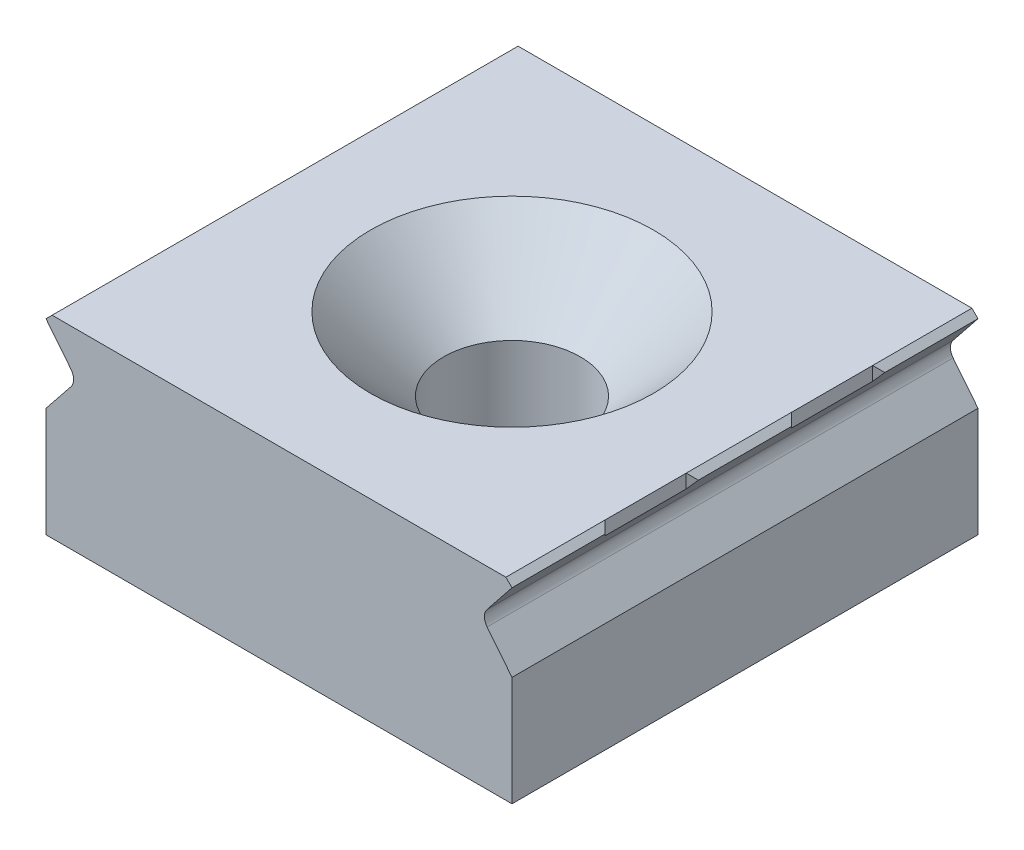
SolidWorks part; units mm, degrees
ref_plane "Front Plane" through (0, 0, 0) normal (0, 0, 1) x (1, 0, 0)
ref_plane "Top Plane" through (0, 0, 0) normal (0, 1, 0) x (1, 0, 0)
ref_plane "Right Plane" through (0, 0, 0) normal (1, 0, 0) x (0, 0, -1)
sketch "Sketch1" plane through (0, 0, 0) normal (0, 1, 0) x (1, 0, 0)
  line L1 (9.55, -9.55) -> (-9.55, -9.55)
  line L2 (9.55, -9.55) -> (9.55, 9.55)
  line L3 (9.55, 9.55) -> (-9.55, 9.55)
  line L4 (-9.55, -9.55) -> (-9.55, 9.55)
  line L5 (9.55, -9.55) -> (-9.55, 9.55) construction
  line L6 (9.55, 9.55) -> (-9.55, -9.55) construction
  point P0 (0, 0)
  dimension "D1" = 19.1
  dimension "D2" = 19.1
extrude "Boss-Extrude1" add sketch "Sketch1" along normal mid plane 7.92
chamfer "Chamfer1" distance 0.25 angle 45 2 edges at (9.55, 3.96, 0) (-9.55, 3.96, 0)
sketch "Sketch2" plane through (0, 0, 9.55) normal (0, 0, 1) x (1, 0, 0)
  line L0 (-9.55, 3.71) -> (-9.55, 0.53)
  line L1 (-9.55, 3.71) -> (-9.55, -3.96) construction
  line L2 (-9.55, 3.71) -> (-8.5292, 2.432)
  line L3 (-8.5292, 1.808) -> (-9.55, 0.53)
  arc A0 (-8.5292, 2.432) -> (-8.5292, 1.808) centre (-8.9199, 2.12) cw
  point P8 (-8.28, 2.12)
  dimension "D4" = 0.5
  dimension "D1" = 3.18
  dimension "D2" = 1.59
  dimension "D3" = 1.27
extrude "Cut-Extrude1" cut sketch "Sketch2" against normal up to surface (19.1 mm away)
mirror "Mirror1" about plane through (0, 0, 0) normal (1, 0, 0) of "Cut-Extrude1"
sketch "Sketch3" plane through (0, 3.96, 0) normal (0, 1, 0) x (1, 0, 0)
  line L0 (-9.55, -5.73) -> (-9.55, -1.91)
  line L1 (-9.55, -9.55) -> (-9.55, 9.55) construction
  line L2 (-9.55, -1.91) -> (-9.3, -2.16)
  line L3 (-9.3, 9.55) -> (-9.3, -9.55) construction
  line L4 (-9.3, -2.16) -> (-9.3, -5.48)
  line L5 (-9.3, -5.48) -> (-9.55, -5.73)
  line L6 (-9.3, -9.55) -> (-9.55, -9.55) construction
  line L7 (9.55, -5.73) -> (9.3, -5.48)
  line L8 (9.55, 9.55) -> (9.55, -9.55) construction
  line L9 (9.3, -9.55) -> (9.3, 9.55) construction
  line L10 (9.3, -5.48) -> (9.3, -2.16)
  line L11 (9.3, -2.16) -> (9.55, -1.91)
  line L12 (9.55, -1.91) -> (9.55, -5.73)
  line L13 (-9.3, -9.55) -> (9.3, -9.55) construction
  dimension "D1" = 3.82
  dimension "D2" = 90
  dimension "D3" = 3.82
  dimension "D4" = 3.82
extrude "Cut-Extrude2" cut sketch "Sketch3" against normal blind 1
pattern_linear "LPattern1" count 2 spacing 7.64 along (0, 0, -1) of "Cut-Extrude2"
sketch "Sketch4" plane through (0, 3.96, 0) normal (0, 1, 0) x (1, 0, 0)
  circle A0 centre (0, 0) radius 2.8
  dimension "D1" = 5.6
extrude "Cut-Extrude3" cut sketch "Sketch4" against normal up to surface (7.92 mm away)
chamfer "Chamfer2" distance 3 angle 45 1 edges at (0, 3.96, 2.8)
